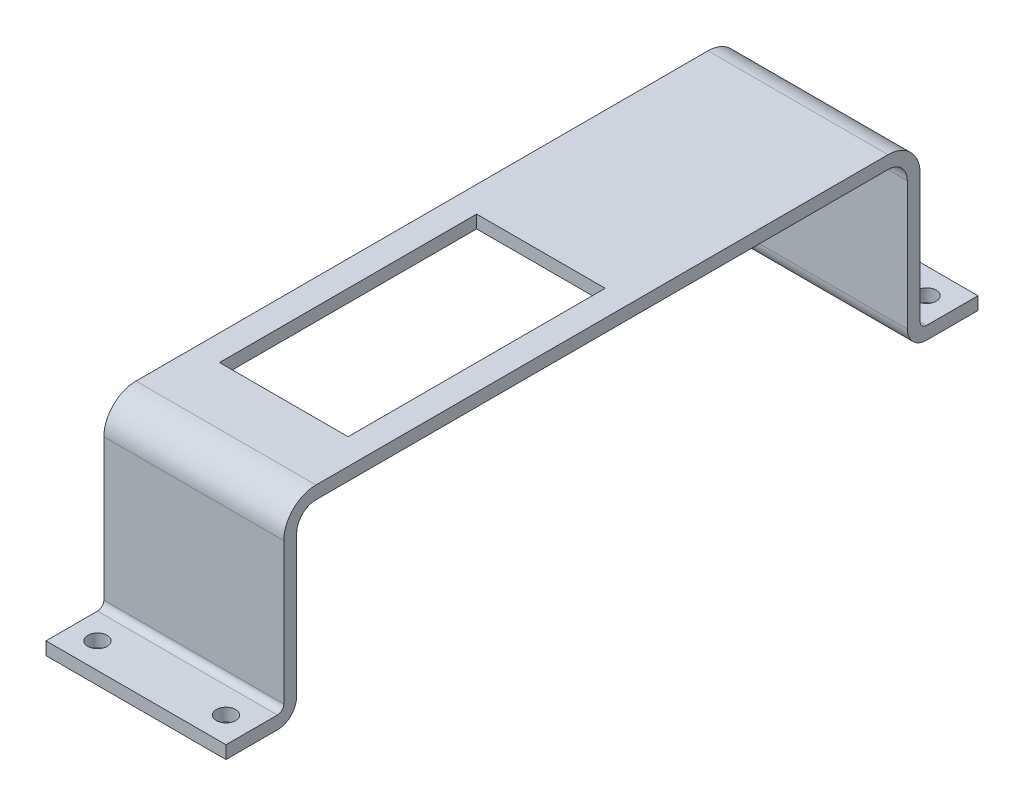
SolidWorks part; units mm, degrees
ref_plane "Front Plane" through (0, 0, 0) normal (0, 0, 1) x (1, 0, 0)
ref_plane "Top Plane" through (0, 0, 0) normal (0, 1, 0) x (1, 0, 0)
ref_plane "Right Plane" through (0, 0, 0) normal (1, 0, 0) x (0, 0, -1)
sketch "Sketch1" plane through (0, 0, 0) normal (1, 0, 0) x (0, 0, -1)
  line L0 (3, 0) -> (11, 0)
  line L2 (-3, 26) -> (-92, 26)
  line L3 (-95, 23) -> (-95, 1)
  line L4 (-98, -2) -> (-106, -2)
  line L5 (0, 23) -> (0, 3)
  line L6 (2, 23) -> (2, 3)
  line L7 (-3, 28) -> (-92, 28)
  line L8 (-97, 23) -> (-97, 1)
  line L9 (-98, 0) -> (-106, 0)
  line L10 (3, 2) -> (11, 2)
  line L11 (11, 2) -> (11, 0)
  line L12 (-106, 0) -> (-106, -2)
  arc A0 (-3, 26) -> (0, 23) centre (-3, 23) cw
  arc A1 (-92, 26) -> (-95, 23) centre (-92, 23) ccw
  arc A2 (-95, 1) -> (-98, -2) centre (-98, 1) cw
  arc A3 (0, 3) -> (3, 0) centre (3, 3) ccw
  arc A4 (2, 3) -> (3, 2) centre (3, 3) ccw
  arc A5 (-3, 28) -> (2, 23) centre (-3, 23) cw
  arc A6 (-92, 28) -> (-97, 23) centre (-92, 23) ccw
  arc A7 (-97, 1) -> (-98, 0) centre (-98, 1) cw
  point P9 (0, 26)
  point P14 (-95, -2)
  dimension "D6" = 3
  dimension "D7" = 2
  dimension "D1" = 3
  dimension "D2" = 95
  dimension "D3" = 11
  dimension "D4" = 11
  dimension "D5" = 26
  dimension "D8" = 2
extrude "Boss-Extrude1" add sketch "Sketch1" along normal mid plane 28
sketch "Sketch2" plane through (0, 28, 0) normal (0, 1, 0) x (1, 0, 0)
  line L0 (0, 0) -> (0, -109.3837) construction
  line L1 (-10, -43) -> (10, -43)
  line L2 (-10, -43) -> (-10, -83)
  line L3 (-10, -83) -> (10, -83)
  line L4 (10, -43) -> (10, -83)
  line L5 (14, -97) -> (-14, -97) construction
  dimension "D1" = 14
  dimension "D2" = 20
  dimension "D3" = 40
  dimension "D4" = 10
extrude "Cut-Extrude1" cut sketch "Sketch2" against normal through all
sketch "Sketch3" plane through (0, 0, 0) normal (0, 1, 0) x (1, 0, 0)
  line L0 (0, 0) -> (0, -109.973) construction
  line L1 (14, -98) -> (14, -106) construction
  line L2 (14, -106) -> (-14, -106) construction
  line L3 (-14, -98) -> (-14, -106) construction
  circle A0 centre (10, -102) radius 1.5
  circle A1 centre (-10, -102) radius 1.5
  point P7 (14, -102)
  dimension "D1" = 3
  dimension "D2" = 3
  dimension "D5" = 4
  dimension "D3" = 4
  dimension "D4" = 4
  dimension "D6" = 4
extrude "Cut-Extrude2" cut sketch "Sketch3" against normal through all
sketch "Sketch4" plane through (0, 2, 0) normal (0, 1, 0) x (1, 0, 0)
  line L0 (0, 0) -> (0, 13.9416) construction
  line L1 (14, 11) -> (-14, 11) construction
  line L2 (14, 11) -> (14, 3) construction
  line L3 (-14, 11) -> (-14, 3) construction
  circle A0 centre (10, 7) radius 1.5
  circle A1 centre (-10, 7) radius 1.5
  dimension "D1" = 3
  dimension "D2" = 3
  dimension "D3" = 4
  dimension "D4" = 4
  dimension "D5" = 4
  dimension "D6" = 4
extrude "Cut-Extrude3" cut sketch "Sketch4" against normal through all
